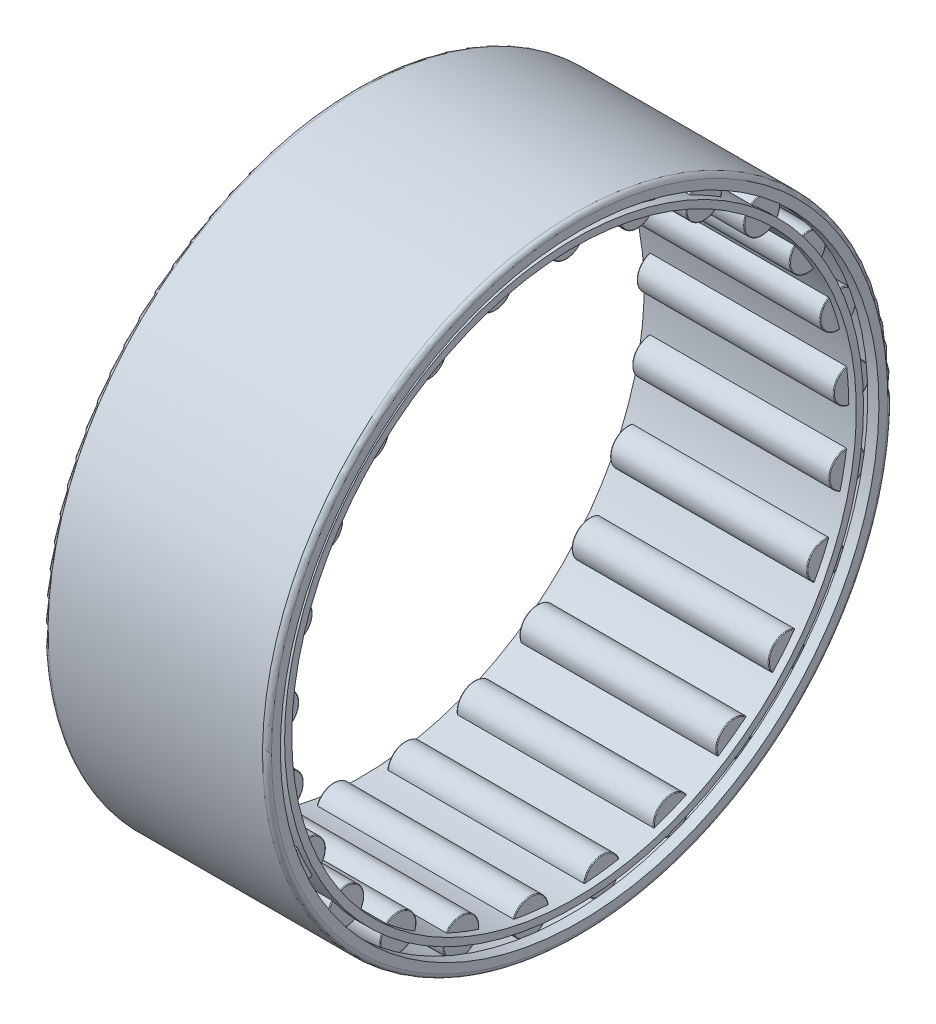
SolidWorks part; units mm, degrees
ref_plane "Plane1" through (0, 0, 0) normal (0, 0, 1) x (1, 0, 0)
ref_plane "Plane2" through (0, 0, 0) normal (0, 1, 0) x (1, 0, 0)
ref_plane "Plane3" through (0, 0, 0) normal (1, 0, 0) x (0, 0, -1)
sketch "Clipboard" plane through (0, 0, 0) normal (0, 0, 1) x (1, 0, 0)
  line L0 (-10, 0) -> (10, 0) construction
  line L1 (0, 0) -> (20.2657, -9.45)
  line L2 (0, 0) -> (36.8323, 17.1752)
  line L3 (0, 0) -> (20.2657, -9.45)
  line L4 (0, 0) -> (-76.2, -2.661)
  dimension "BallCLRad" = 40.64
  dimension "Count" = 25
  dimension "Show_count" = 25
  dimension "Max_count" = 25
  dimension "Min_count" = 2
  dimension "Bore" = 76.2
sketch "InnRacSke" plane through (0, 0, 0) normal (0, 0, 1) x (1, 0, 0)
  line L0 (-14.2875, 42.545) -> (-15.875, 42.545)
  line L1 (-15.875, 42.545) -> (-15.875, 43.815)
  line L2 (-15.24, 44.45) -> (15.24, 44.45)
  line L4 (15.875, 43.815) -> (15.875, 42.545)
  line L5 (15.875, 42.545) -> (14.2875, 42.545)
  line L6 (14.2875, 42.545) -> (14.2875, 43.18)
  line L7 (14.2875, 43.18) -> (-14.2875, 43.18)
  line L8 (-14.2875, 43.18) -> (-14.2875, 42.545)
  line L9 (-31.75, 0) -> (31.75, 0) construction
  arc A0 (-15.875, 43.815) -> (-15.24, 44.45) centre (-15.24, 43.815) cw
  arc A2 (15.24, 44.45) -> (15.875, 43.815) centre (15.24, 43.815) cw
  dimension "radius" = 0.635
  dimension "D1" = 86.36
  dimension "OD" = 88.9
  dimension "Width" = 31.75
  dimension "groove_dp" = 0.635
  dimension "Cyl_Len" = 28.575
  dimension "halfCyl" = 14.2875
revolve "Race" add sketch "InnRacSke" angle 360 about L9
sketch "RolDetSke" plane through (0, 0, 0) normal (0, 0, 1) x (1, 0, 0)
  line L0 (-14.0018, 43.0906) -> (-14.0017, 40.64)
  line L1 (-14.0017, 40.64) -> (14.0017, 40.64)
  line L2 (14.0017, 40.64) -> (14.0018, 43.0906)
  line L3 (13.8996, 43.1927) -> (-13.8996, 43.1927)
  line L4 (-28.575, 40.64) -> (28.575, 40.64) construction
  arc A0 (14.0018, 43.0906) -> (13.8996, 43.1927) centre (13.8996, 43.0906) ccw
  arc A1 (-13.8996, 43.1927) -> (-14.0018, 43.0906) centre (-13.8996, 43.0906) ccw
  dimension "Roller_radius" = 0.1021
  dimension "Roller_diameter" = 5.1054
  dimension "Roller_length" = 28.0035
  dimension "RollerCLRad" = 40.64
  dimension "halfLength" = 14.0017
revolve "RollerDetailed" add sketch "RolDetSke" angle 360 about L4
ref_axis "Axis1" through (-50, 0, 0) along (1, 0, 0)
sketch "CagSpiSke" plane through (0, 0, 0) normal (0, 0, 1) x (1, 0, 0)
  line L0 (15.0812, 40.1295) -> (15.0812, 41.1505)
  line L1 (15.0812, 41.1505) -> (-15.0813, 41.1505)
  line L2 (-15.0813, 41.1505) -> (-15.0813, 40.1295)
  line L3 (-15.0813, 40.1295) -> (15.0812, 40.1295)
  line L4 (-31.75, 0) -> (31.75, 0) construction
  dimension "Cage_width" = 30.1625
  dimension "D2" = 80.2589
  dimension "Cage_thickness" = 1.0211
  dimension "halfWidth" = 15.0812
revolve "CageSpine" add sketch "CagSpiSke" angle 360 about L4
pattern_circular "RollersDetailed" count 25 every 14.4 about axis through (-50, 0, 0) along (1, 0, 0) of "RollerDetailed"
sketch "RolSimSke" plane through (0, 0, 0) normal (0, 0, 1) x (1, 0, 0)
  line L0 (-25.4, 0) -> (25.4, 0) construction
  line L2 (-13.8996, 43.2054) -> (13.8996, 43.2054)
  line L3 (-14.0018, 43.1033) -> (-14.0018, 38.2021)
  line L4 (-13.8996, 38.1) -> (13.8996, 38.1)
  line L5 (14.0017, 43.1033) -> (14.0017, 38.2021)
  arc A0 (-14.0018, 38.2021) -> (-13.8996, 38.1) centre (-13.8996, 38.2021) ccw
  arc A1 (-13.8996, 43.2054) -> (-14.0018, 43.1033) centre (-13.8996, 43.1033) ccw
  arc A2 (14.0017, 43.1033) -> (13.8996, 43.2054) centre (13.8996, 43.1033) ccw
  arc A3 (13.8996, 38.1) -> (14.0017, 38.2021) centre (13.8996, 38.2021) ccw
  point P10 (-14.0018, 38.1)
  point P15 (14.0017, 43.2054)
  point P18 (14.0017, 38.1)
  dimension "D1" = 0.1021
  dimension "Bore" = 76.2
  dimension "Roller_length" = 28.0035
  dimension "Roller_diameter" = 5.1054
  dimension "halfWidth" = 14.0017
revolve "RollersSimplified" [suppressed] add sketch "RolSimSke" angle 360 about L0
equation "\"BallCLRad@Clipboard\" =  ( \"D1@InnRacSke\" + \"Bore@Clipboard\" )  / 4"
equation "\"RollerCLRad@RolDetSke\" = \"BallCLRad@Clipboard\""
equation "\"halfCyl@InnRacSke\" = \"Cyl_Len@InnRacSke\" / 2"
equation "\"Roller_length@RolDetSke\" = \"Cyl_Len@InnRacSke\" * .98"
equation "\"halfLength@RolDetSke\" = \"Roller_length@RolDetSke\" / 2"
equation "\"Roller_diameter@RolDetSke\" =  ( \"D1@InnRacSke\" - \"Bore@Clipboard\" )  / 2 + .001"
equation "\"Roller_radius@RolDetSke\" = \"Roller_diameter@RolDetSke\" / 50"
equation "\"Cage_width@CagSpiSke\" =  ( \"Cyl_Len@InnRacSke\" + \"Width@InnRacSke\" )  / 2"
equation "\"halfWidth@CagSpiSke\" = \"Cage_width@CagSpiSke\" / 2"
equation "\"Cage_thickness@CagSpiSke\"  = \"Roller_diameter@RolDetSke\" / 5"
equation "\"D2@CagSpiSke\" =  \"RollerCLRad@RolDetSke\" * 2 - \"Cage_thickness@CagSpiSke\""
equation "\"Roller_length@RolSimSke\" = \"Cyl_Len@InnRacSke\" * .98"
equation "\"halfWidth@RolSimSke\" = \"Roller_length@RolSimSke\" / 2"
equation "\"D1@RolSimSke\" = \"Roller_radius@RolDetSke\""
equation "\"Roller_diameter@RolSimSke\" =  ( \"D1@InnRacSke\" - \"Bore@Clipboard\" )  / 2 + .001"
equation "\"Bore@RolSimSke\" = \"Bore@Clipboard\""
equation "\"Max_count@Clipboard\" = int( 3.14159265 / atn(( \"Roller_diameter@RolDetSke\" / 2) / sqr( \"RollerCLRad@RolDetSke\"  *  \"RollerCLRad@RolDetSke\" - ( \"Roller_diameter@RolDetSke\" / 2) *  ( \"Roller_diameter@R"
equation "\"Max_count@Clipboard\" = ((sgn( \"Max_count@Clipboard\" - \"Count@Clipboard\" )-1)*( \"Max_count@Clipboard\" - \"Count@Clipboard\" ))/-2+ \"Count@Clipboard\""
equation "\"Count@RollersDetailed\" = int( \"Show_count@Clipboard\" ) "
equation "\"Count@RollersDetailed\" = ((sgn( \"Count@RollersDetailed\" - \"Max_count@Clipboard\" )-1)*( \"Count@RollersDetailed\" - \"Max_count@Clipboard\" ))/-2+ \"Max_count@Clipboard\""
equation "\"Count@RollersDetailed\" = ((sgn( \"Count@RollersDetailed\" - \"Min_count@Clipboard\" )+1)*( \"Count@RollersDetailed\" - \"Min_count@Clipboard\"))/2 +\"Min_count@Clipboard\""
equation "\"Angle@RollersDetailed\" = 360.0 / \"Max_count@Clipboard\""
equation "\"Angle@CageSpine\" =  \"Angle@RollersDetailed\" * ( \"Count@RollersDetailed\" -1 + int( \"Count@RollersDetailed\" / \"Max_count@Clipboard\" ) )  + 0.001 -  int( \"Count@RollersDetailed\" / \"Max_count@Clipboard\" "
equation "\"Angle@CageSpine\" =  \"Angle@CageSpine\" * int( \"Min_count@Clipboard\" / 2) + int(1 / \"Min_count@Clipboard\")  * 0.001"
